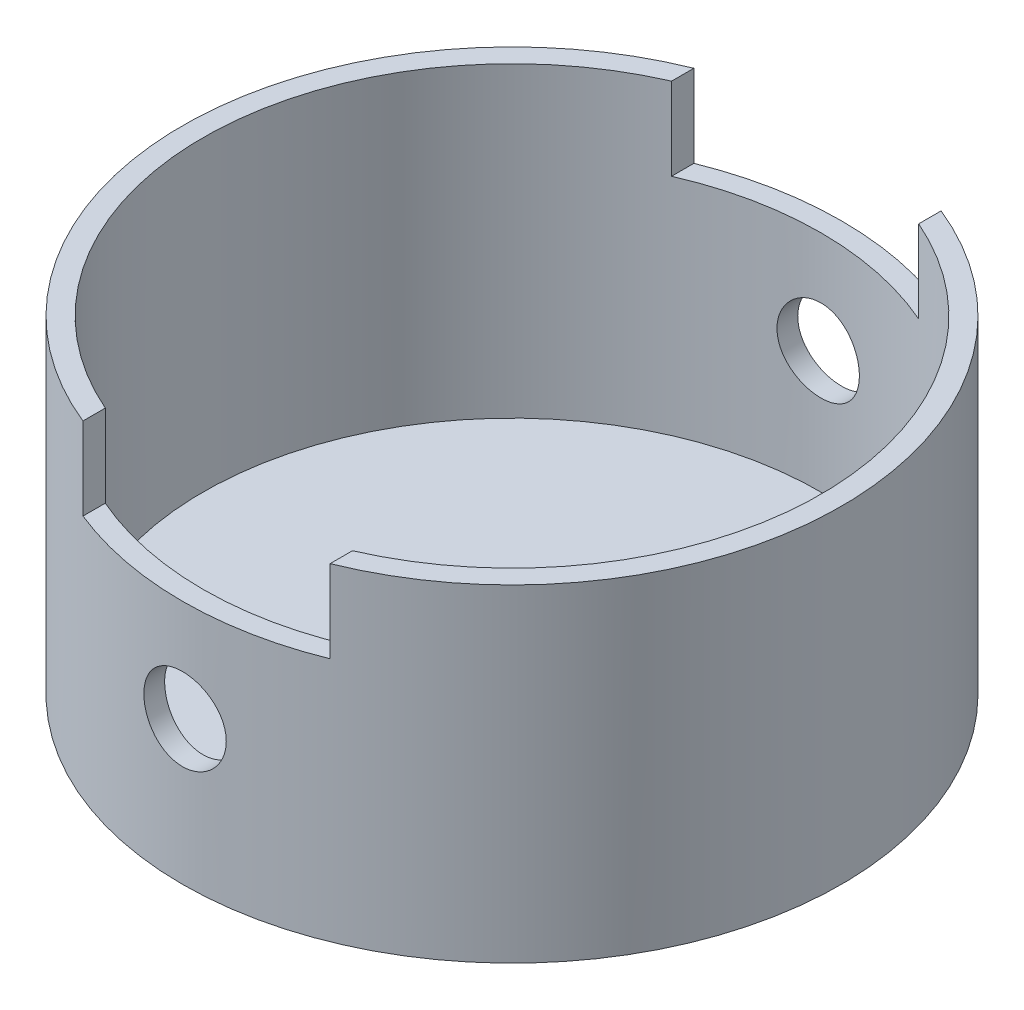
SolidWorks part; units mm, degrees
other "DetailItem1" parameters "RD1"=101.6, "RD2"=38.1, "RD3"=22.0726, "RD4"=3.175, "RD5"=50.4952, "RD6"=12.7
ref_plane "Front Plane" through (0, 0, 0) normal (0, 0, 1) x (1, 0, 0)
ref_plane "Top Plane" through (0, 0, 0) normal (0, 1, 0) x (1, 0, 0)
ref_plane "Right Plane" through (0, 0, 0) normal (1, 0, 0) x (0, 0, -1)
sketch "Sketch1" plane through (0, 0, 0) normal (0, 1, 0) x (1, 0, 0)
  circle A0 centre (0, 0) radius 50.8
  dimension "D1" = 101.6
extrude "Extrude1" add sketch "Sketch1" along normal blind 50.4952
shell "Shell1" thickness 3.175
sketch "Sketch2" plane through (0, 0, 0) normal (0, 0, 1) x (1, 0, 0)
  line L0 (47.625, 50.4952) -> (-47.625, 50.4952) construction
  line L1 (-19.05, 50.4952) -> (19.05, 50.4952)
  line L2 (-19.05, 50.4952) -> (-19.05, 37.7952)
  line L3 (-19.05, 37.7952) -> (19.05, 37.7952)
  line L4 (19.05, 50.4952) -> (19.05, 37.7952)
  line L5 (0, 37.7952) -> (0, 0) construction
  dimension "D1" = 38.1
  dimension "D2" = 12.7
extrude "Extrude2" cut sketch "Sketch2" against normal through all and the other way through all
sketch "Sketch3" plane through (0, 0, 0) normal (0, 0, 1) x (1, 0, 0)
  line L0 (-50.8, 0) -> (50.8, 0) construction
  line L1 (0, 22.0726) -> (0, 0) construction
  circle A0 centre (0, 22.0726) radius 6.35
  dimension "D1" = 12.7
  dimension "D2" = 22.0726
extrude "Extrude3" cut sketch "Sketch3" against normal through all and the other way through all
